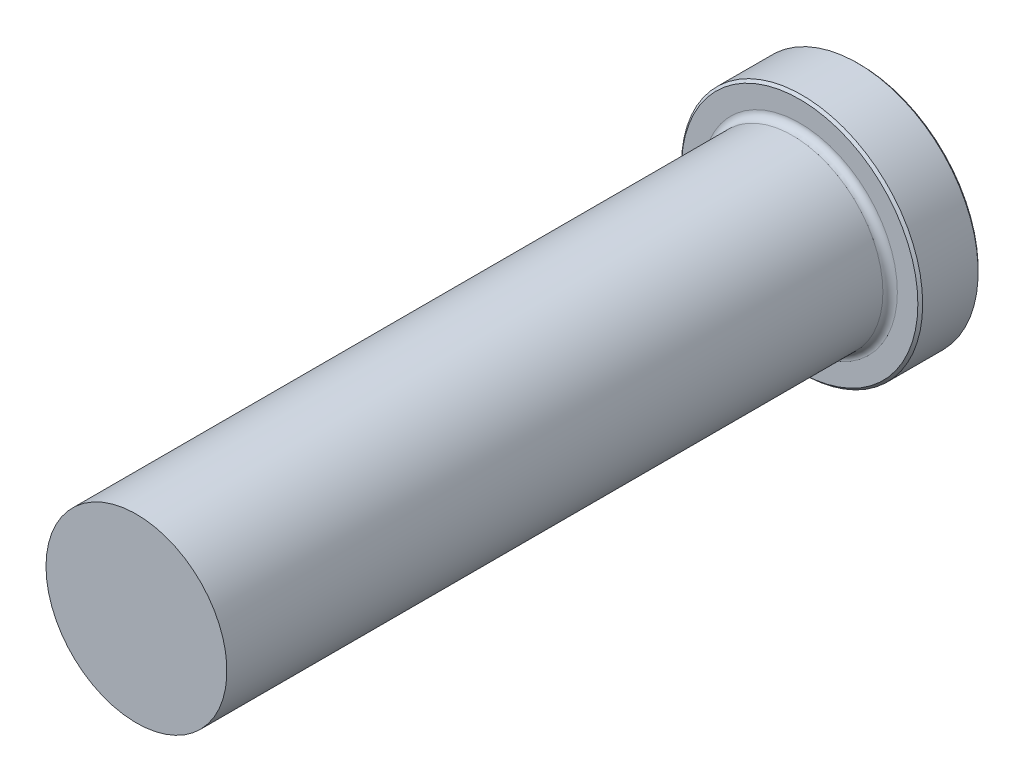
SolidWorks part; units mm, degrees
ref_plane "Front Plane" through (0, 0, 0) normal (0, 0, 1) x (1, 0, 0)
ref_plane "Top Plane" through (0, 0, 0) normal (0, 1, 0) x (1, 0, 0)
ref_plane "Right Plane" through (0, 0, 0) normal (1, 0, 0) x (0, 0, -1)
sketch "Sketch1" plane through (0, 0, 0) normal (1, 0, 0) x (0, 0, -1)
  line L0 (0, 0) -> (-156.8087, 0) construction
  line L1 (0, 0) -> (0, 12.7)
  line L2 (0, 12.7) -> (-6.35, 12.7)
  line L3 (-6.35, 12.7) -> (-6.35, 9.525)
  line L4 (-6.35, 9.525) -> (-76.2, 9.525)
  line L5 (-76.2, 9.525) -> (-76.2, 0)
  line L6 (-76.2, 0) -> (0, 0)
  dimension "D1" = 25.4
  dimension "D2" = 19.05
  dimension "D3" = 6.35
  dimension "D4" = 76.2
revolve "Revolve1" add sketch "Sketch1" angle 360 about L0
fillet "Fillet1" radius 0.762 1 edges at (-9.525, 0, 6.35)
chamfer "Chamfer1" distance 0.254 angle 45 2 edges at (-12.7, 0, 0) (-12.7, 0, 6.35)
